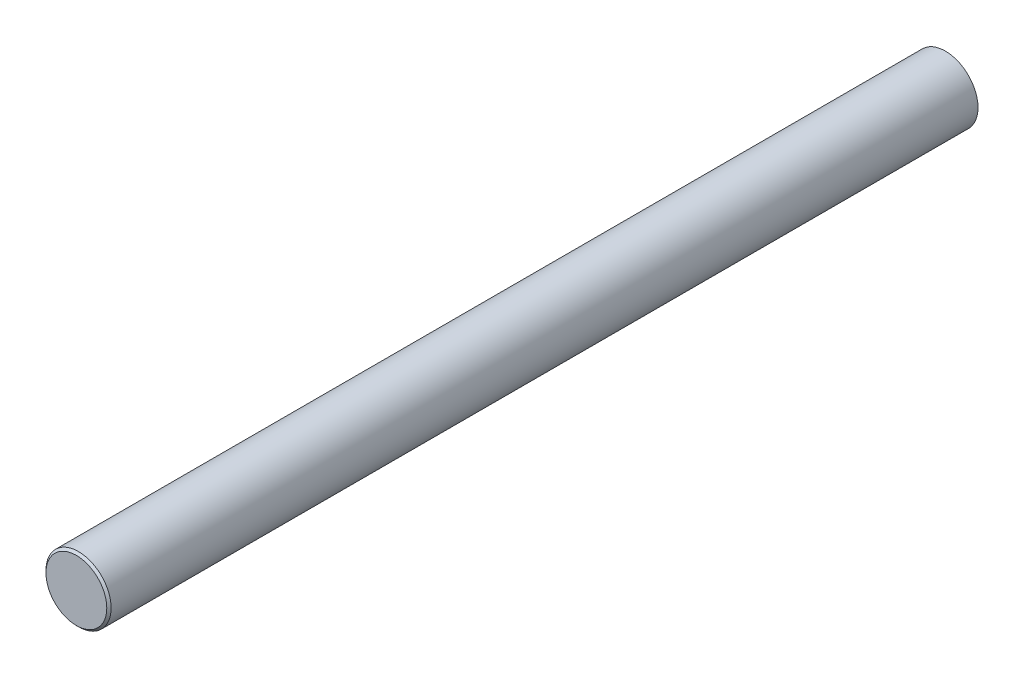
SolidWorks part; units mm, degrees
ref_plane "Plan1" through (0, 0, 0) normal (0, 0, 1) x (1, 0, 0)
ref_plane "Plan2" through (0, 0, 0) normal (0, 1, 0) x (1, 0, 0)
ref_plane "Plan3" through (0, 0, 0) normal (1, 0, 0) x (0, 0, -1)
sketch "Esquisse1" plane through (0, 0, 0) normal (0, 0, 1) x (1, 0, 0)
  circle A0 centre (0, 0) radius 15
extrude "Base-Extrusion" add sketch "Esquisse1" along normal blind 400
chamfer "Chanfrein1" distance 1 angle 45
